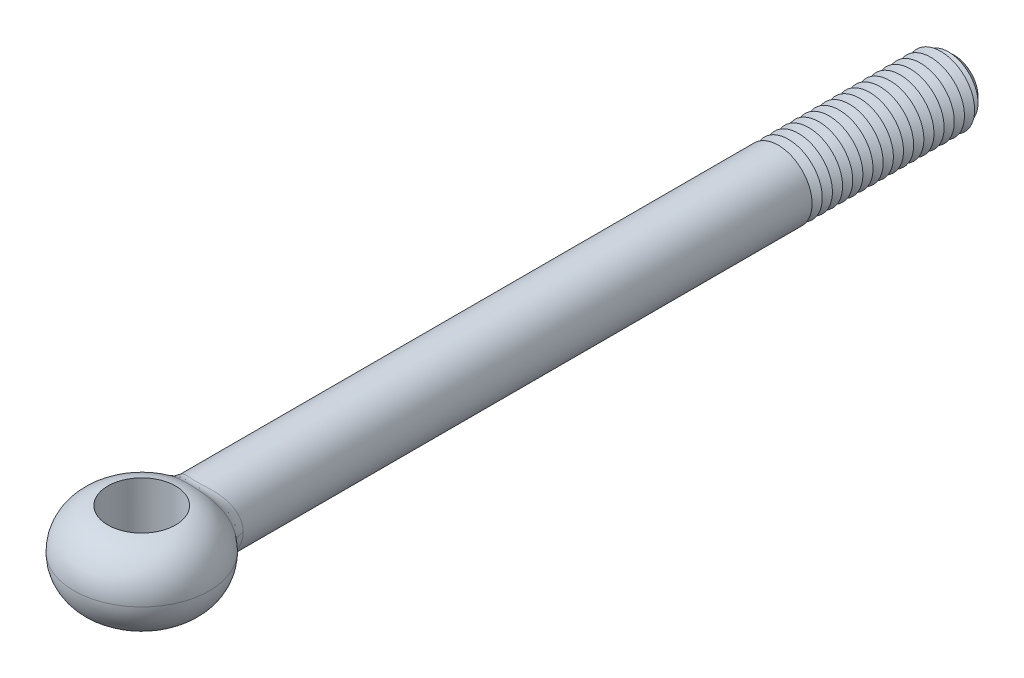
SolidWorks part; units mm, degrees
ref_plane "Front Plane" through (0, 0, 0) normal (0, 0, 1) x (1, 0, 0)
ref_plane "Top Plane" through (0, 0, 0) normal (0, 1, 0) x (1, 0, 0)
ref_plane "Right Plane" through (0, 0, 0) normal (1, 0, 0) x (0, 0, -1)
sketch "Sketch7" plane through (0, 0, 0) normal (0, 1, 0) x (1, 0, 0)
  circle A0 centre (0, 0) radius 10
  dimension "D1" = 20
extrude "Boss-Extrude3" add sketch "Sketch7" along normal mid plane 12
sketch "Sketch8" plane through (0, 0, 0) normal (0, 0, 1) x (1, 0, 0)
  circle A0 centre (0, 0) radius 5
  dimension "D1" = 10
extrude "Boss-Extrude4" add sketch "Sketch8" against normal blind 120
fillet "Fillet5" radius 6 2 edges at (0, -6, 10) (0, 6, 10)
fillet "Fillet6" radius 2.5 2 edges at (-0.0154, -5, -7.3166) (0.0154, 5, -7.3166)
chamfer "Chamfer1" distance 1.5 angle 45 1 edges at (5, 0, -120)
sketch "Sketch10" plane through (0, 0, 0) normal (0, 1, 0) x (1, 0, 0)
  line L0 (0, 28.1405) -> (0, -7.9233) construction
sketch "Sketch11" plane through (0, 0, 0) normal (0, 1, 0) x (1, 0, 0)
  line L0 (-5, 94) -> (-3.701, 94.75)
  line L1 (-5, 118.5) -> (-5, 10) construction
  line L2 (-3.701, 94.75) -> (-5, 95.5)
  line L3 (-5, 95.5) -> (-5, 94)
  line L4 (3.5, 120) -> (-3.5, 120) construction
  dimension "D1" = 1.5
  dimension "D2" = 26
revolve "Cut-Revolve1" cut sketch "Sketch11" angle 360 about L0
pattern_linear "LPattern1" count 17 spacing 1.5 along (0, 0, -1) of "Cut-Revolve1"
sketch "Sketch12" plane through (0, 0, 0) normal (0, 1, 0) x (1, 0, 0)
  circle A0 centre (0, 0) radius 5
  dimension "D1" = 10
extrude "Cut-Extrude1" cut sketch "Sketch12" against normal mid plane 12
